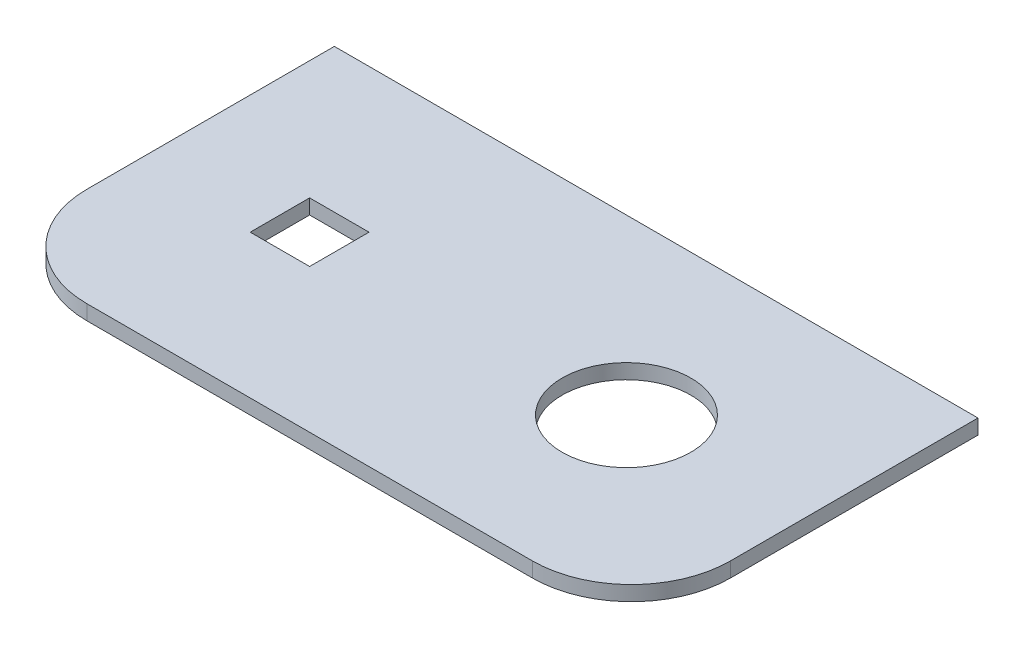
SolidWorks part; units mm, degrees
ref_plane "Alzado" through (0, 0, 0) normal (0, 0, 1) x (1, 0, 0)
ref_plane "Planta" through (0, 0, 0) normal (0, 1, 0) x (1, 0, 0)
ref_plane "Vista lateral" through (0, 0, 0) normal (1, 0, 0) x (0, 0, -1)
sketch "Sketch1" plane through (0, 0, 0) normal (0, 1, 0) x (1, 0, 0)
  line L0 (-10.8181, 35) -> (182.5653, 35) construction
  line L1 (20, 0) -> (110, 0)
  line L2 (0, 20) -> (0, 70)
  line L3 (0, 70) -> (130, 70)
  line L4 (130, 20) -> (130, 70)
  line L6 (24, 41) -> (36, 41)
  line L7 (24, 41) -> (24, 29)
  line L8 (24, 29) -> (36, 29)
  line L9 (36, 41) -> (36, 29)
  line L10 (24, 41) -> (36, 29) construction
  line L11 (24, 29) -> (36, 41) construction
  circle A1 centre (94, 35) radius 13
  arc A2 (110, 0) -> (130, 20) centre (110, 20) ccw
  arc A3 (20, 0) -> (0, 20) centre (20, 20) cw
  point P7 (30, 35)
  point P16 (0, 0)
  point P19 (0, 0)
  dimension "D3" = 35
  dimension "D4" = 30
  dimension "D5" = 12
  dimension "D6" = 23
  dimension "D7" = 26
  dimension "D8" = 20
  dimension "D1" = 70
  dimension "D2" = 130
extrude "Boss-Extrude1" add sketch "Sketch1" along normal blind 3
